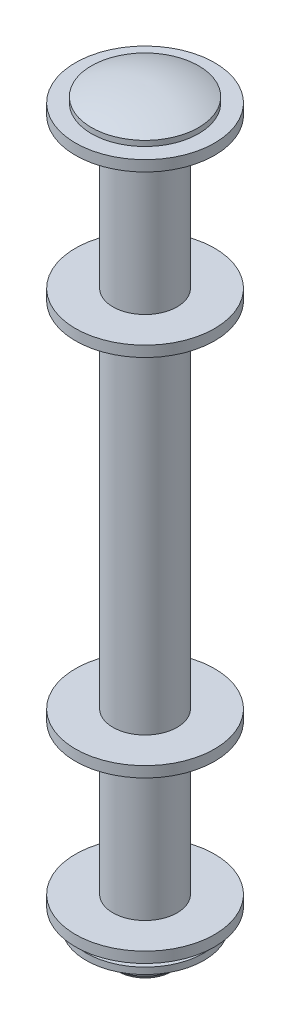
SolidWorks part; units mm, degrees
ref_plane "正面" through (0, 0, 0) normal (0, 0, 1) x (1, 0, 0)
ref_plane "平面" through (0, 0, 0) normal (0, 1, 0) x (1, 0, 0)
ref_plane "右側面" through (0, 0, 0) normal (1, 0, 0) x (0, 0, -1)
sketch "ｽｹｯﾁ2" plane through (0, 0, 0) normal (0, 0, 1) x (1, 0, 0)
  line L22 (0, 0) -> (0, 70.5)
  line L23 (5, 69) -> (5, 69.5)
  line L24 (5.5, 3) -> (5.5, 2.4)
  line L25 (2.5, 2.4) -> (2.5, 2.3)
  line L26 (2.5, 0) -> (3, 0.5)
  line L27 (3, 2.3) -> (3, 0.5)
  line L28 (3, 2.3) -> (2.5, 2.3)
  line L29 (0, 0) -> (2.5, 0)
  line L30 (5.5, 3) -> (3, 3)
  line L31 (5.5, 2.4) -> (2.5, 2.4)
  line L32 (3, 4) -> (3, 3)
  line L33 (6.5, 68) -> (3, 68)
  line L34 (6.5, 69) -> (5, 69)
  line L35 (6.5, 69) -> (6.5, 68)
  line L36 (6.5, 54) -> (6.5, 53)
  line L37 (6.5, 54) -> (3, 54)
  line L38 (6.5, 53) -> (3, 53)
  line L39 (6.5, 20) -> (6.5, 19)
  line L40 (6.5, 20) -> (3, 20)
  line L41 (6.5, 19) -> (3, 19)
  line L42 (6.5, 5) -> (6.5, 4)
  line L43 (6.5, 5) -> (3, 5)
  line L44 (6.5, 4) -> (3, 4)
  line L45 (3, 20) -> (3, 53)
  line L46 (3, 54) -> (3, 68)
  line L47 (3, 19) -> (3, 5)
  arc A0 (5, 69.5) -> (0, 70.5) centre (0.25, 58.75) ccw
revolve "回転1" add sketch "ｽｹｯﾁ2" angle 360 about L22
